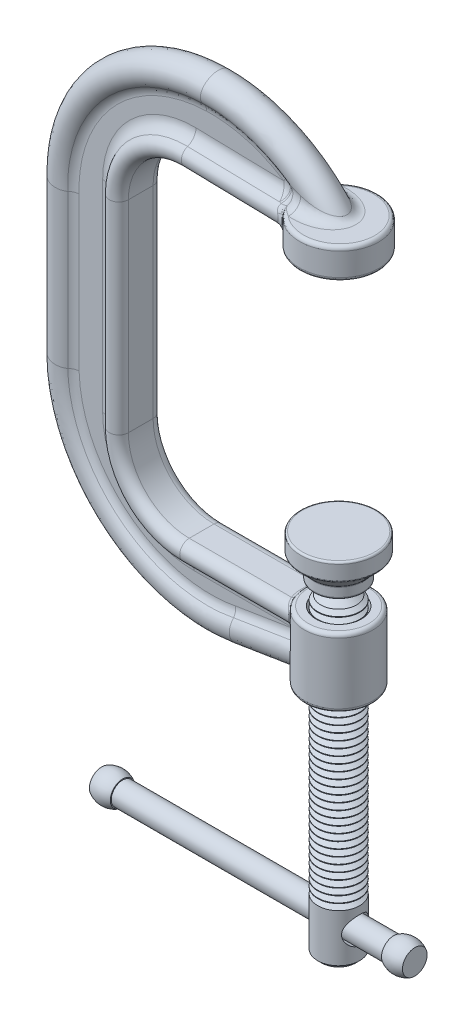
SolidWorks part; units mm, degrees
ref_plane "Front Plane" through (0, 0, 0) normal (0, 0, 1) x (1, 0, 0)
ref_plane "Top Plane" through (0, 0, 0) normal (0, 1, 0) x (1, 0, 0)
ref_plane "Right Plane" through (0, 0, 0) normal (1, 0, 0) x (0, 0, -1)
sketch "Sketch1" plane through (0, 0, 0) normal (0, 0, 1) x (1, 0, 0)
  line L0 (0, 102.3938) -> (-64.5175, 102.3938) construction
  line L1 (-133.35, 33.5613) -> (-133.35, -30.3863)
  line L2 (-53.5466, -98.3388) -> (0, -89.6937)
  line L3 (0, -89.6937) -> (0, -67.4687)
  line L4 (0, -67.4687) -> (-71.4375, -67.4688)
  line L5 (-96.8375, 42.0687) -> (-96.8375, -42.0688)
  line L6 (-70.8709, 67.4624) -> (0, 65.8813) construction
  line L7 (0, 65.8813) -> (0, 102.3938) construction
  line L8 (0, 0) -> (-96.8375, 0) construction
  line L9 (-70.8709, 67.4624) -> (-3.175, 65.9521)
  line L11 (-64.5175, -99.2187) -> (5.3328, -99.2187) construction
  arc A0 (-70.8709, 67.4624) -> (-96.8375, 42.0687) centre (-71.4375, 42.0687) ccw
  arc A1 (-96.8375, -42.0688) -> (-71.4375, -67.4688) centre (-71.4375, -42.0688) ccw
  arc A2 (-64.5175, 102.3938) -> (-133.35, 33.5613) centre (-64.5175, 33.5613) ccw
  arc A3 (-133.35, -30.3863) -> (-53.5466, -98.3388) centre (-64.5175, -30.3863) ccw
  arc A4 (-64.5175, 102.3938) -> (-3.175, 65.9521) centre (-64.5175, 32.5438) cw
  dimension "D2" = 133.35
  dimension "D3" = 96.8375
  dimension "D7" = 69.85
  dimension "D6" = 25.4
  dimension "D1" = 31.75
  dimension "D4" = 133.35
  dimension "D5" = 201.6125
  dimension "D9" = 99.2187
  dimension "D10" = 22.225
  dimension "D11" = 3.175
extrude "Extrude1" add sketch "Sketch1" along normal mid plane 6.35
sketch "Sketch2" plane through (0, 0, 0) normal (1, 0, 0) x (0, 0, -1)
  line L0 (-3.175, -67.4688) -> (3.175, -67.4688) construction
  line L1 (-9.1281, -67.4688) -> (9.1281, -67.4688) construction
  line L2 (-9.1281, -67.4688) -> (-9.1281, -75.4062) construction
  line L3 (-9.1281, -75.4062) -> (9.1281, -75.4062) construction
  line L4 (9.1281, -67.4688) -> (9.1281, -75.4062) construction
  line L5 (0, -98.3388) -> (0, -67.4688) construction
  line L6 (-3.175, -98.3388) -> (3.175, -98.3388) construction
  line L7 (-3.175, -89.6937) -> (-3.175, -67.4687) construction
  line L9 (3.175, -89.6937) -> (3.175, -67.4687) construction
  line L10 (-5.1594, -67.4688) -> (5.1594, -67.4688)
  line L11 (-3.175, -80.1688) -> (3.175, -80.1688)
  arc A0 (-5.1594, -67.4688) -> (-6.6092, -75.132) centre (-5.1594, -71.4375) ccw
  arc A1 (-6.6092, -75.132) -> (-3.175, -80.1688) centre (-8.5857, -80.1688) cw
  arc A2 (5.1594, -67.4688) -> (6.6092, -75.132) centre (5.1594, -71.4375) cw
  arc A3 (6.6092, -75.132) -> (3.175, -80.1688) centre (8.5857, -80.1688) ccw
  dimension "D4" = 5.4107
  dimension "D1" = 7.9375
  dimension "D2" = 18.2562
  dimension "D3" = 12.7
sketch "Sketch3" plane through (0, 0, 0) normal (0, 0, 1) x (1, 0, 0)
  line L0 (0, -67.4687) -> (-71.4375, -67.4688)
  line L1 (0, -67.4687) -> (-71.4375, -67.4688) construction
  line L2 (-70.8709, 67.4624) -> (-3.175, 65.9521)
  line L3 (-96.8375, -42.0688) -> (-96.8375, 42.0687)
  arc A0 (-96.8375, -42.0688) -> (-71.4375, -67.4688) centre (-71.4375, -42.0688) ccw construction
  arc A1 (-70.8709, 67.4624) -> (-96.8375, 42.0687) centre (-71.4375, 42.0687) ccw
  arc A2 (-96.8375, -42.0688) -> (-71.4375, -67.4688) centre (-71.4375, -42.0688) ccw
  arc A3 (-70.8709, 67.4624) -> (-96.8375, 42.0687) centre (-71.4375, 42.0687) ccw construction
sweep "Sweep1" add profiles "Sketch2" path "Sketch3"
sketch "Sketch4" plane through (0, 0, 0) normal (1, 0, 0) x (0, 0, -1)
  line L0 (0, -67.4688) -> (0, -83.3438) construction
  line L2 (-5.1594, -67.4688) -> (5.1594, -67.4688) construction
  line L3 (-3.175, -89.6937) -> (3.175, -89.6937) construction
  circle A0 centre (0, -83.3438) radius 6.35
  dimension "D1" = 12.7
sketch "Sketch5" plane through (0, 0, 0) normal (0, 0, 1) x (1, 0, 0)
  line L0 (-133.35, 33.5613) -> (-133.35, -30.3863)
  line L1 (0, -89.6937) -> (-53.5466, -98.3388)
  arc A0 (-64.5175, 102.3938) -> (-133.35, 33.5613) centre (-64.5175, 33.5613) ccw
  arc A1 (-133.35, -30.3863) -> (-53.5466, -98.3388) centre (-64.5175, -30.3863) ccw
  arc A2 (-4.6271, 68.4904) -> (-64.5175, 102.3938) centre (-64.5175, 32.5438) ccw
  arc A5 (-133.35, -30.3863) -> (-53.5466, -98.3388) centre (-64.5175, -30.3863) ccw construction
  arc A7 (-64.5175, 102.3938) -> (-133.35, 33.5613) centre (-64.5175, 33.5613) ccw construction
  arc A9 (-12.2291, 78.8572) -> (-64.5175, 102.3938) centre (-64.5175, 32.5438) ccw construction
sweep "Sweep2" add profiles "Sketch4" path "Sketch5"
sketch "Sketch6" plane through (0, 0, 0) normal (1, 0, 0) x (0, 0, -1)
  line L0 (-6.35, -83.3438) -> (-9.1281, -83.3438)
  line L2 (-9.1281, -83.3438) -> (-9.1281, -108.7438)
  line L3 (-9.1281, -42.0687) -> (-9.1281, -71.4375) construction
  line L5 (0, -83.3438) -> (0, -110.6061) construction
  line L6 (9.1281, -83.3438) -> (9.1281, -108.7438)
  line L7 (6.35, -83.3438) -> (9.1281, -83.3438)
  line L8 (-9.1281, -108.7438) -> (9.1281, -108.7438)
  arc A0 (-6.35, -83.3438) -> (6.35, -83.3438) centre (0, -83.3438) ccw
  arc A2 (-3.585, -78.1026) -> (-3.175, -88.843) centre (0, -83.3438) ccw construction
  dimension "D1" = 25.4
sketch "Sketch7" plane through (0, 0, 0) normal (0, 0, 1) x (1, 0, 0)
  line L0 (-133.35, 33.5613) -> (-133.35, -30.3863)
  line L2 (0, -89.6937) -> (-53.5466, -98.3388)
  arc A1 (-64.5175, 102.3938) -> (-133.35, 33.5613) centre (-64.5175, 33.5613) ccw
  arc A2 (-64.5175, 102.3938) -> (-133.35, 33.5613) centre (-64.5175, 33.5613) ccw construction
  arc A4 (-16.0027, -17.709) -> (-64.5175, 102.3938) centre (-64.5175, 32.5438) ccw
  arc A5 (-12.2291, 78.8572) -> (-64.5175, 102.3938) centre (-64.5175, 32.5438) ccw construction
  arc A6 (-133.35, -30.3863) -> (-53.5466, -98.3388) centre (-64.5175, -30.3863) ccw
sweep "Cut-Sweep1" cut profiles "Sketch6" path "Sketch7"
ref_plane "Plane1" through (0, -65.8812, 0) normal (0, 1, 0) x (-1, 0, 0)
ref_plane "Plane2" through (0, 62.7063, 0) normal (0, 1, 0) x (-1, 0, 0)
sketch "Sketch8" plane through (0, -65.8812, 0) normal (0, 1, 0) x (-1, 0, 0)
  line L4 (0, 0) -> (14.2875, 0) construction
  line L5 (-0.7938, 9.1281) -> (3.2961, 9.1281)
  line L7 (71.4375, 9.1281) -> (0, 9.1281) construction
  line L8 (-0.7937, -9.1281) -> (3.2961, -9.1281)
  line L11 (-0.7938, 9.1281) -> (-0.7937, -9.1281)
  line L12 (0, -9.1281) -> (71.4375, -9.1281) construction
  line L16 (0, 5.1594) -> (0, -5.1594) construction
  arc A0 (3.2961, 9.1281) -> (3.2961, -9.1281) centre (14.2875, 0) ccw
  dimension "D1" = 28.575
  dimension "D2" = 0.7937
extrude "Extrude2" cut sketch "Sketch8" against normal through all and the other way through all
sketch "Sketch9" plane through (0, -65.8812, 0) normal (0, 1, 0) x (-1, 0, 0)
  circle A0 centre (14.2875, 0) radius 14.2875
  arc A1 (3.2961, 9.1281) -> (3.2961, -9.1281) centre (14.2875, 0) ccw construction
extrude "Extrude3" add sketch "Sketch9" against normal blind 28.702
sketch "Sketch10" plane through (0, 62.7063, 0) normal (0, 1, 0) x (-1, 0, 0)
  line L0 (14.2875, 16.2719) -> (-9.4346, 16.2719) construction
  line L1 (0, 0) -> (14.2875, 0) construction
  line L2 (30.9563, 0) -> (30.9563, 24.3604) construction
  circle A1 centre (14.2875, 0) radius 14.2875 construction
  ellipse E0 centre (14.2875, 0) end of major axis (-2.3812, 0) minor radius 16.2719
  dimension "D1" = 32.5437
  dimension "D2" = 33.3375
extrude "Extrude4" add sketch "Sketch10" along normal blind 12.7
sketch "Sketch11" plane through (0, -65.8812, 0) normal (0, 1, 0) x (-1, 0, 0)
  circle A0 centre (14.2875, 0) radius 9.525
  dimension "D1" = 19.05
extrude "Extrude5" cut sketch "Sketch11" against normal up to next
fillet "Fillet1" radius 1.5875 4 edges at (-28.575, -94.5832, 0) (-28.575, -65.8812, 0) (2.3812, 62.7063, 0) (2.3812, 75.4063, 0)
fillet "Fillet2" radius 4.7625 12 edges at (-40.8822, -84.4449, -3.175) (-40.8822, -84.4449, 3.175) (-100.1206, -75.1116, -3.175) (-100.1206, -75.1116, 3.175) (-121.6522, -0.3011, -3.175) (-121.6522, -0.3011, 3.175) (-106.2533, 72.6262, -3.175) (-106.2533, 72.6262, 3.175) (-29.0293, 78.6715, -3.2041) (-47.1442, 88.0723, -3.175) (-47.1442, 88.0723, 3.175)
fillet "Fillet3" radius 4.7625 10 edges at (-14.1574, 75.4063, 5.8667) (-29.2313, 75.0812, 5.6937) (-28.3158, 68.8762, 8.7886) (-30.9558, 66.5719, -0.1134) (-28.1361, 69.7259, -9.0561) (-29.3613, 74.9365, -5.812) (-12.4151, 75.4063, -5.107)
fillet "Fillet4" radius 1.5875 10 edges at (-27.6303, -76.0227, 5.1092) (-25.3356, -70.7022, 9.0594) (-28.575, -67.4688, 0) (-28.5237, -71.8275, -1.2098) (-28.0487, -77.5662, -3.842) (-28.0897, -82.2429, -3.6922) (-27.1349, -88.841, -6.2511) (-28.5742, -94.3051, -0.1554) (-27.0908, -88.0573, 6.3409) (-28.1959, -81.019, 3.2693)
sketch "Sketch12" plane through (0, 0, 0) normal (0, 0, 1) x (1, 0, 0)
  line L0 (-14.2875, -65.8812) -> (-14.2875, 108.3763) construction
  line L1 (-4.7625, -65.8812) -> (-23.8125, -65.8812) construction
  line L2 (-30.1625, -38.8937) -> (-14.2875, -38.8937)
  line L3 (-30.1625, -38.8937) -> (-30.1625, -46.0375)
  line L4 (-30.1625, -46.0375) -> (-24.6062, -51.5937)
  line L5 (-24.6062, -51.5937) -> (-24.6062, -56.3562)
  line L6 (-24.6062, -56.3562) -> (-22.225, -56.3562)
  line L7 (-14.2875, 43.6563) -> (-14.2875, -38.8937) construction
  line L8 (-29.3688, 62.7063) -> (0.7937, 62.7063) construction
  line L9 (-22.225, -56.3562) -> (-22.225, -53.6437)
  line L10 (-14.2875, -38.8937) -> (-14.2875, -41.275)
  line L11 (-18.2563, -56.8803) -> (-18.2562, -59.5312)
  line L12 (-23.0187, -62.7062) -> (-18.2562, -59.5312)
  line L13 (-23.0187, -62.7062) -> (-23.0187, -191.2937)
  line L14 (-23.0187, -191.2937) -> (-14.2875, -191.2937)
  line L15 (-14.2875, -42.0687) -> (-14.2875, -191.2937)
  line L16 (-14.2875, -191.2937) -> (-13.8816, -190.2326)
  arc A0 (-14.2875, -41.275) -> (-22.225, -53.6437) centre (-14.2875, -50.0062) ccw
  arc A1 (-14.2875, -42.0687) -> (-18.2563, -56.8803) centre (-14.2875, -50.0062) ccw
  dimension "D8" = 8.7312
  dimension "D10" = 15.875
  dimension "D1" = 31.75
  dimension "D2" = 101.6
  dimension "D3" = 7.1437
  dimension "D4" = 17.4625
  dimension "D5" = 12.7
  dimension "D6" = 20.6375
  dimension "D7" = 15.875
  dimension "D9" = 6.35
  dimension "D11" = 20.6375
  dimension "D12" = 152.4
  dimension "D13" = 17.4625
  dimension "D14" = 7.9375
  dimension "D15" = 23.8125
revolve "Revolve1" add sketch "Sketch12" angle 360 about L0
sketch "Sketch13" plane through (0, 0, 0) normal (-1, 0, 0) x (0, 0, 1)
  line L0 (0, -191.2937) -> (0, -178.5938) construction
  line L1 (-8.7312, -191.2937) -> (8.7312, -191.2937) construction
  circle A0 centre (0, -178.5938) radius 5.5562
  dimension "D2" = 11.1125
  dimension "D1" = 12.7
extrude "Extrude6" cut sketch "Sketch13" along normal through all
sketch "Sketch14" plane through (0, 0, 0) normal (0, 0, 1) x (1, 0, 0)
  line L0 (-5.5563, -173.0375) -> (-5.5563, -62.7062) construction
  line L1 (13.0969, -172.2438) -> (22.1736, -172.2438) construction
  line L2 (17.4625, -173.4344) -> (8.7313, -173.4344) construction
  line L3 (8.7313, -173.4344) -> (8.7313, -173.8312)
  line L4 (17.4625, -178.5938) -> (17.4625, -173.4344)
  line L5 (-5.5563, -178.5938) -> (24.2544, -178.5938) construction
  line L6 (8.7313, -173.8312) -> (-104.3623, -173.8312)
  line L7 (-113.0935, -178.5938) -> (-113.0935, -173.4344)
  line L8 (-113.0935, -178.5938) -> (17.4625, -178.5938)
  line L9 (-14.2875, -191.2937) -> (-14.2875, -113.3238) construction
  line L10 (-23.0187, -191.2937) -> (-5.5563, -191.2937) construction
  line L11 (-47.8155, -178.5938) -> (-47.8155, -124.7485) construction
  line L12 (-113.0935, -173.4344) -> (-104.3623, -173.4344) construction
  line L13 (-108.7279, -172.2438) -> (-117.8046, -172.2438) construction
  line L14 (-104.3623, -173.4344) -> (-104.3623, -173.8312)
  line L15 (-5.5563, -173.0375) -> (-5.5563, -184.15) construction
  arc A0 (17.4625, -173.4344) -> (8.7313, -173.4344) centre (13.0969, -180.8427) ccw
  arc A1 (-113.0935, -173.4344) -> (-104.3623, -173.4344) centre (-108.7279, -180.8427) cw
  dimension "D1" = 130.556
  dimension "D2" = 9.525
  dimension "D3" = 12.7
  dimension "D4" = 0.3969
  dimension "D5" = 8.7312
  dimension "D6" = 31.75
revolve "Revolve2" add sketch "Sketch14" angle 360 about L8
chamfer "Chamfer1" distance 1.5875 angle 45 1 edges at (-14.2875, -191.2937, -8.7312)
chamfer "Chamfer2" distance 0.7937 angle 45 1 edges at (-14.2875, -56.3562, -7.9375)
fillet "Fillet5" radius 0.7937 4 edges at (-14.2875, -56.3562, -10.3187) (-14.2875, -51.5937, -10.3187) (-14.2875, -46.0375, -15.875) (-14.2875, -38.8937, -15.875)
sketch "Sketch15" plane through (0, 0, 0) normal (0, 0, 1) x (1, 0, 0)
  line L0 (-23.0187, -169.815) -> (-20.819, -168.545)
  line L1 (-23.0187, -62.7062) -> (-23.0187, -173.0375) construction
  line L2 (-20.819, -168.545) -> (-23.0187, -167.275)
  line L3 (-23.0187, -62.7062) -> (-23.0187, -173.0375) construction
  line L4 (-23.0187, -167.275) -> (-23.0187, -169.815)
  line L5 (-20.819, -168.545) -> (-23.0187, -168.545) construction
  dimension "D1" = 2.54
  dimension "D2" = 60
revolve "Cut-Revolve1" cut sketch "Sketch15" angle 360 about axis through (-14.2875, -65.8812, 0) along (0, -1, 0)
pattern_linear "LPattern1" count 42 spacing 2.794 along (0, 1, 0) of "Cut-Revolve1"
